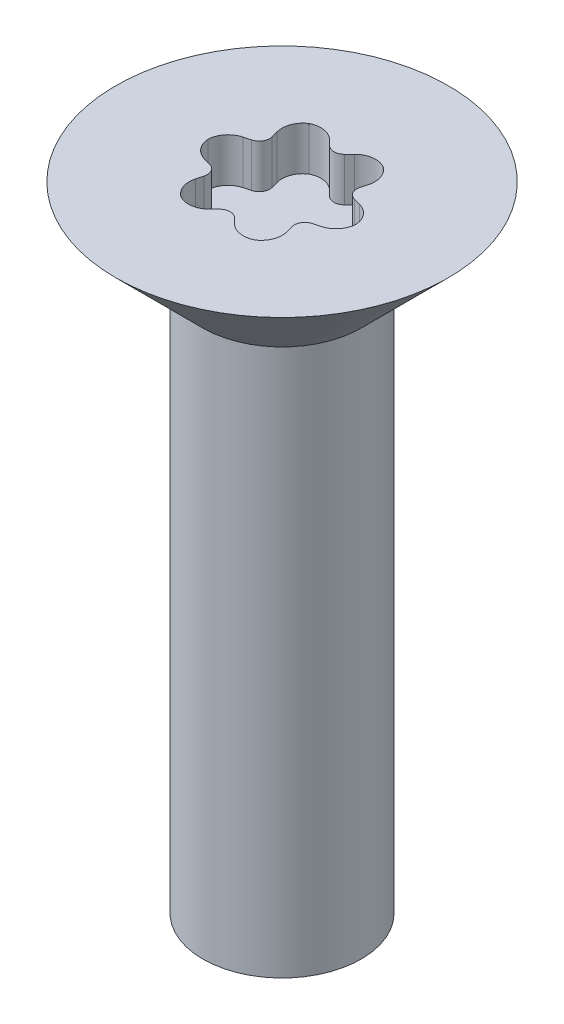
SolidWorks part; units mm, degrees
ref_plane "Aufriss" through (0, 0, 0) normal (0, 0, 1) x (1, 0, 0)
ref_plane "Grundriss" through (0, 0, 0) normal (0, 1, 0) x (1, 0, 0)
ref_plane "Seitenriss" through (0, 0, 0) normal (1, 0, 0) x (0, 0, -1)
sketch "Skizze1" plane through (0, 0, 0) normal (0, 1, 0) x (1, 0, 0)
  circle A0 centre (0, 0) radius 1.5
  dimension "D1" = 3
extrude "Aufsatz-Linear austragen1" add sketch "Skizze1" along normal blind 10.35
sketch "Skizze3" plane through (0, 10.35, 0) normal (0, 1, 0) x (1, 0, 0)
  circle A0 centre (0, 0) radius 1.5
  dimension "D1" = 3
extrude "Aufsatz-Linear austragen3" add sketch "Skizze3" along normal blind 1.65 draft 45
sketch "Skizze4" plane through (0, 12, 0) normal (0, 1, 0) x (1, 0, 0)
  line L0 (-0.4318, 1.3318) -> (0, 0.9)
  line L1 (0, 0.9) -> (0.4318, 1.3318)
  line L2 (0, 0) -> (0, 1.4) construction
  line L3 (0.7794, 0.45) -> (1.3692, 0.292)
  line L4 (0.9375, 1.0398) -> (0.7794, 0.45)
  line L5 (0.7794, -0.45) -> (0.9375, -1.0398)
  line L6 (1.3692, -0.292) -> (0.7794, -0.45)
  line L7 (0, -0.9) -> (-0.4318, -1.3318)
  line L8 (0.4318, -1.3318) -> (0, -0.9)
  line L9 (-0.7794, -0.45) -> (-1.3692, -0.292)
  line L10 (-0.9375, -1.0398) -> (-0.7794, -0.45)
  line L11 (-0.7794, 0.45) -> (-0.9375, 1.0398)
  line L12 (-1.3692, 0.292) -> (-0.7794, 0.45)
  circle A0 centre (0, 0) radius 1.4
  point P23 (0.0913, 0.0527)
  point P25 (0, 0)
  dimension "D1" = 2.8
  dimension "D2" = 45
  dimension "D3" = 6
  dimension "D4" = 0.9
extrude "Schnitt-Linear austragen1" cut sketch "Skizze4" against normal blind 0.83
fillet "Verrundung3" radius 0.4 12 edges at (0.4318, 11.585, -1.3318) (0.9375, 11.585, -1.0398) (1.3692, 11.585, -0.292) (1.3692, 11.585, 0.292) (0.9375, 11.585, 1.0398) (0.4318, 11.585, 1.3318) (-0.4318, 11.585, 1.3318) (-0.9375, 11.585, 1.0398) (-1.3692, 11.585, 0.292) (-1.3692, 11.585, -0.292) (-0.9375, 11.585, -1.0398) (-0.4318, 11.585, -1.3318)
fillet "Verrundung4" radius 0.2 6 edges at (0.7794, 11.585, 0.45) (0, 11.585, 0.9) (-0.7794, 11.585, 0.45) (-0.7794, 11.585, -0.45) (0, 11.585, -0.9) (0.7794, 11.585, -0.45)
